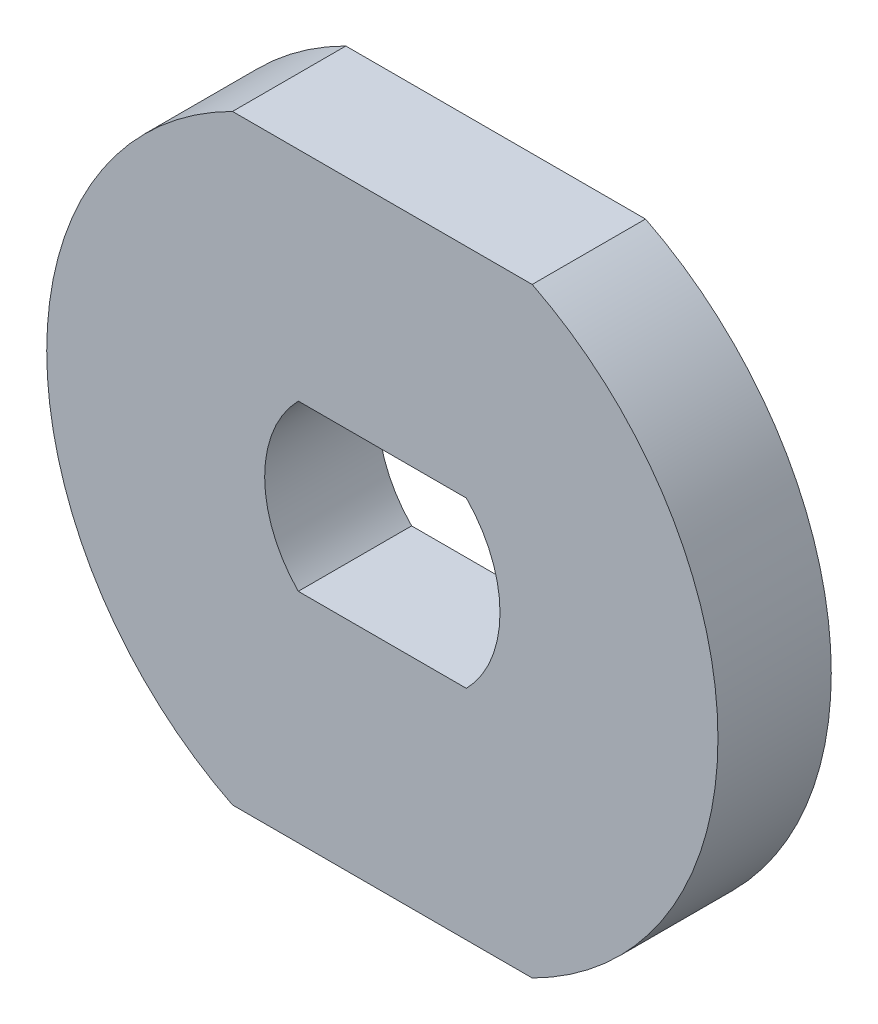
SolidWorks part; units mm, degrees
ref_plane "Alzado" through (0, 0, 0) normal (0, 0, 1) x (1, 0, 0)
ref_plane "Planta" through (0, 0, 0) normal (0, 1, 0) x (1, 0, 0)
ref_plane "Vista lateral" through (0, 0, 0) normal (1, 0, 0) x (0, 0, -1)
sketch "Croquis1" plane through (0, 0, 0) normal (0, 0, 1) x (1, 0, 0)
  line L1 (-14.9377, 23.4794) -> (-8.0623, 23.4794)
  line L2 (-14.9377, 9.6994) -> (-8.0623, 9.6994)
  line L4 (-13.4282, 14.6994) -> (-9.5718, 14.6994)
  line L5 (-13.4282, 18.4794) -> (-9.5718, 18.4794)
  arc A0 (-13.4282, 18.4794) -> (-13.4282, 14.6994) centre (-11.5, 16.5894) ccw
  arc A1 (-9.5718, 14.6994) -> (-9.5718, 18.4794) centre (-11.5, 16.5894) ccw
  arc A2 (-8.0623, 9.6994) -> (-8.0623, 23.4794) centre (-11.5, 16.5894) ccw
  arc A3 (-14.9377, 23.4794) -> (-14.9377, 9.6994) centre (-11.5, 16.5894) ccw
  point P2 (-14.2, 14.6994)
  point P3 (-8.8, 14.6994)
  point P4 (-14.2, 18.4794)
  point P5 (-8.8, 18.4794)
  dimension "D1" = 5
extrude "Saliente-Extruir1" add sketch "Croquis1" along normal blind 2.6
